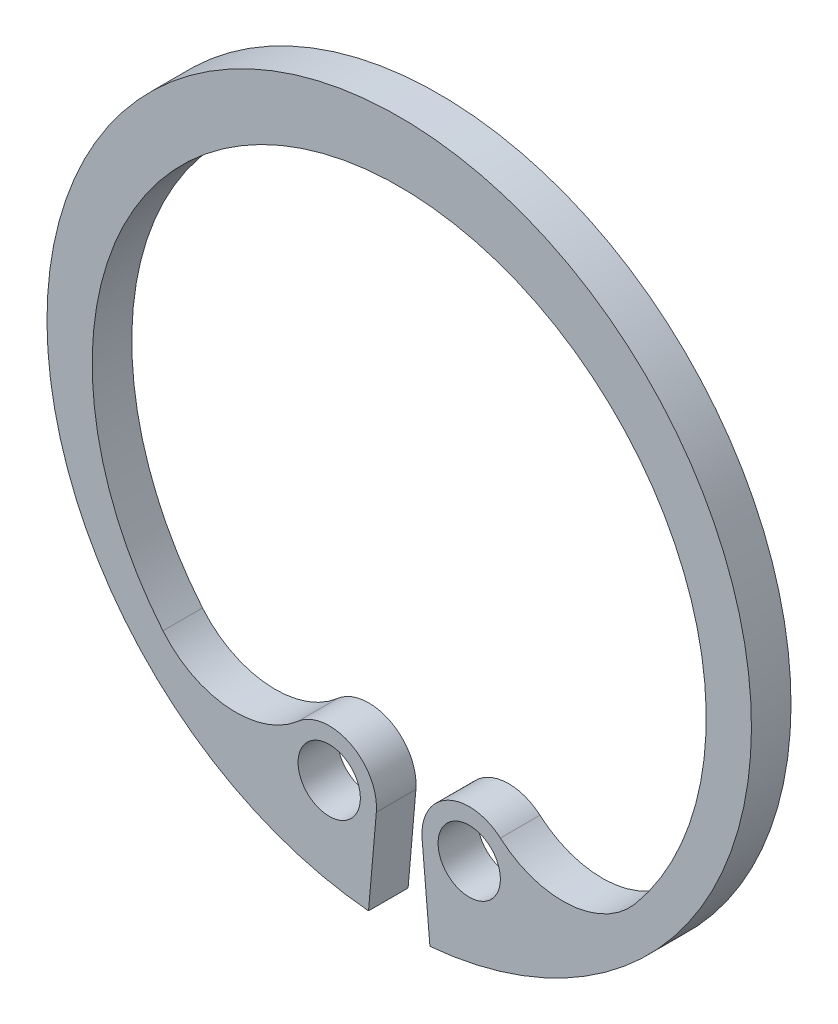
SolidWorks part; units mm, degrees
ref_plane "Plane1" through (0, 0, 0) normal (0, 0, 1) x (1, 0, 0)
ref_plane "Plane2" through (0, 0, 0) normal (0, 1, 0) x (1, 0, 0)
ref_plane "Plane3" through (0, 0, 0) normal (1, 0, 0) x (0, 0, -1)
extrude "Body" add sketch "BodySke" against normal blind 1
sketch "BodySke" plane through (0, 0, 0) normal (0, 0, 1) x (1, 0, 0)
  line L0 (-1.5431, 0) -> (1.5431, 0) construction
  line L1 (0, 0) -> (0, 7.376) construction
  line L2 (0.7757, -8.8661) -> (0.5783, -6.6103)
  line L3 (-0.7757, -8.8661) -> (-0.5783, -6.6103)
  line L4 (0, 0) -> (6.5433, -6.0329) construction
  line L5 (0, 0) -> (-6.5433, -6.0329) construction
  line L6 (-1.7003, -5.7218) -> (-1.8376, -7.2906) construction
  line L7 (1.7035, -5.7584) -> (1.8343, -7.2539) construction
  arc A0 (-0.5783, -6.6103) -> (-2.5562, -5.6069) centre (-1.7689, -6.5062) ccw
  arc A1 (2.5562, -5.6069) -> (0.5783, -6.6103) centre (1.7689, -6.5062) ccw
  arc A2 (5.8897, -5.4303) -> (-5.8897, -5.4303) centre (0, -0.3815) ccw construction
  arc A3 (0.7757, -8.8661) -> (-0.7757, -8.8661) centre (0, 0) ccw
  circle A4 centre (1.7689, -6.5062) radius 0.7874
  circle A5 centre (-1.7689, -6.5062) radius 0.7874
  arc A7 (5.9703, -5.3347) -> (-5.9703, -5.3347) centre (0, -0.3815) ccw
  arc A8 (-1.7689, -6.5062) -> (1.7689, -6.5062) centre (0, 0) ccw construction
  arc A9 (-5.9703, -5.3347) -> (-2.5562, -5.6069) centre (-4.1307, -3.8085) ccw
  arc A10 (2.5562, -5.6069) -> (5.9703, -5.3347) centre (4.1307, -3.8085) ccw
  dimension "GrooveDia" = 17.8
  dimension "TipRad" = 1.1952
  dimension "HoleOffsetRad" = 6.7424
  dimension "HoleDia" = 1.5748
  dimension "FilletRad" = 2.3903
  dimension "LargeRad" = 7.376
  dimension "SmallRad" = 8.011
  dimension "SmallAngle" = 94.648
  dimension "GapAngle" = 10
sketch "Clipboard" plane through (0, 0, 0) normal (0, 0, 1) x (1, 0, 0)
  line L0 (0, 0) -> (1.524, 0)
  line L1 (0, 0) -> (0, 0.889)
  line L2 (0, 0) -> (0, -3.3528)
  circle A0 centre (0, 0) radius 0.7874
  circle A1 centre (0, 0) radius 7.9375
  dimension "HoleDia" = 1.5748
  dimension "BoreDia" = 15.875
  dimension "LargeSection" = 1.524
  dimension "SmallSection" = 0.889
  dimension "LugSection" = 3.3528
sketch "ModLugSke" plane through (0, 0, 0) normal (0, 0, 1) x (1, 0, 0)
  line L0 (0.7757, -8.8661) -> (0.5478, -6.2616)
  line L1 (-0.7757, -8.8661) -> (-0.5478, -6.2616)
  line L2 (5.0292, -2.3407) -> (8.0689, -3.7554) construction
  line L3 (-5.0292, -2.3407) -> (-8.0689, -3.7554) construction
  line L4 (-0.7757, -8.8661) -> (-0.5783, -6.6103) construction
  line L5 (0.5783, -6.6103) -> (0.7757, -8.8661) construction
  line L6 (0, 0) -> (0, -12.7358) construction
  line L7 (7.169, -3.3365) -> (8.0689, -3.7554)
  line L8 (-8.0689, -3.7554) -> (-7.169, -3.3365)
  arc A0 (0.7757, -8.8661) -> (8.0689, -3.7554) centre (0, 0) ccw
  arc A1 (-3.2017, -4.53) -> (-1.1666, -5.4231) centre (0, 0) ccw
  arc A2 (0.7757, -8.8661) -> (-0.7757, -8.8661) centre (0, 0) ccw construction
  arc A3 (2.5562, -5.6069) -> (0.5783, -6.6103) centre (1.7689, -6.5062) ccw construction
  arc A4 (-3.2017, -4.53) -> (-3.9997, -4.4644) centre (-3.6562, -5.173) ccw
  arc A5 (-7.169, -3.3365) -> (-3.9997, -4.4644) centre (-5.0292, -2.3407) ccw
  arc A6 (5.9703, -5.3347) -> (-5.9703, -5.3347) centre (0, -0.3815) ccw construction
  arc A7 (3.9997, -4.4644) -> (7.169, -3.3365) centre (5.0292, -2.3407) ccw
  arc A8 (1.1666, -5.4231) -> (3.2017, -4.53) centre (0, 0) ccw
  arc A9 (-8.0689, -3.7554) -> (-0.7757, -8.8661) centre (0, 0) ccw
  circle A10 centre (-1.7689, -6.5062) radius 0.7874
  circle A11 centre (-1.7689, -6.5062) radius 0.7874 construction
  circle A12 centre (1.7689, -6.5062) radius 0.7874
  circle A13 centre (1.7689, -6.5062) radius 0.7874 construction
  arc A14 (-1.1666, -5.4231) -> (-0.5478, -6.2616) centre (-1.3322, -6.1929) cw
  arc A15 (1.1666, -5.4231) -> (0.5478, -6.2616) centre (1.3322, -6.1929) ccw
  arc A16 (3.2017, -4.53) -> (3.9997, -4.4644) centre (3.6562, -5.173) cw
  point P43 (0.4835, -5.5261)
  dimension "LugAng" = 70.504
extrude "ModLug" [suppressed] add sketch "ModLugSke" against normal through all
sketch "Esquisse1" plane through (0, 0, 0) normal (0, 0, 1) x (1, 0, 0)
  line L1 (-10.9369, 10.4749) -> (0, 10.4749)
  line L2 (-10.9369, 10.4749) -> (-10.9369, -9.962)
  line L3 (-10.9369, -9.962) -> (0, -9.962)
  line L4 (0, 10.4749) -> (0, -9.962)
extrude "Coupe" [suppressed] cut sketch "Esquisse1" against normal through all
equation "' \"BoreDia@Clipboard\" = 0.25"
equation "' \"Thickness@Body\" = 0.015"
equation "' \"GrooveDia@BodySke\" = 0.268"
equation "' \"LugSection@Clipboard\" = 0.065"
equation "' \"LargeSection@Clipboard\" = 0.025"
equation "' \"SmallSection@Clipboard\" = 0.015"
equation "' \"HoleDia@Clipboard\" = 0.031"
equation "' \"BoreDia@Clipboard\" = 1.0"
equation "' \"Thickness@Body\" = 0.042"
equation "' \"GrooveDia@BodySke\" = 1.066"
equation "' \"LugSection@Clipboard\" = 0.155"
equation "' \"LargeSection@Clipboard\" = 0.104"
equation "' \"SmallSection@Clipboard\" = 0.052"
equation "' \"HoleDia@Clipboard\" = 0.062"
equation "\"TipRad@BodySke\" = (\"LugSection@Clipboard\" - (\"GrooveDia@BodySke\" / 2  -  \"BoreDia@Clipboard\" / 2 ) ) / 2"
equation "\"HoleOffsetRad@BodySke\" = (\"GrooveDia@BodySke\" / 2) - \"LugSection@Clipboard\"  + \"TipRad@BodySke\""
equation "\"LargeRad@BodySke\" =  \"GrooveDia@BodySke\" / 2 -  \"LargeSection@Clipboard\""
equation "\"SmallRad@BodySke\" =  \"GrooveDia@BodySke\" / 2 -  \"SmallSection@Clipboard\""
equation "\"HoleDia@BodySke\" =  \"HoleDia@Clipboard\""
equation "\"FilletRad@BodySke\" = \"TipRad@BodySke\" * 2"
equation "\"GapAngle@BodySke\" = 360 - 0.97 * 360 * ( \"BoreDia@Clipboard\" /  \"GrooveDia@BodySke\")"
equation "\"LugAng@ModLugSke\" = \"GapAngle@BodySke\"  + 2.5 * 360 * (\"LugSection@Clipboard\" / (\"BoreDia@Clipboard\" * 3.1416))"
